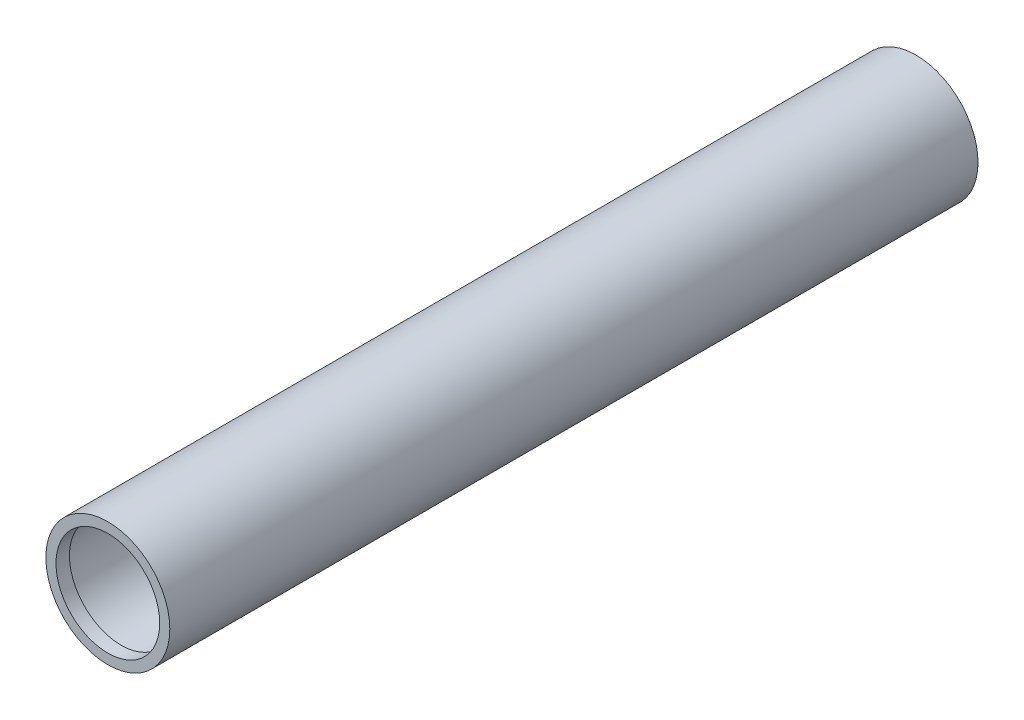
SolidWorks part; units mm, degrees
ref_plane "Front Plane" through (0, 0, 0) normal (0, 0, 1) x (1, 0, 0)
ref_plane "Top Plane" through (0, 0, 0) normal (0, 1, 0) x (1, 0, 0)
ref_plane "Right Plane" through (0, 0, 0) normal (1, 0, 0) x (0, 0, -1)
sketch "Sketch2" plane through (0, 0, 0) normal (0, 0, 1) x (1, 0, 0)
  circle A0 centre (0, 0) radius 23
  dimension "D1" = 46
extrude "Boss-Extrude1" add sketch "Sketch2" along normal blind 300
sketch "Sketch3" plane through (0, 0, 0) normal (0, 0, -1) x (-1, 0, 0)
  circle A0 centre (0, 0) radius 20.75
  dimension "D1" = 41.5
extrude "Cut-Extrude1" cut sketch "Sketch3" against normal blind 295
sketch "Sketch4" plane through (0, 0, 300) normal (0, 0, 1) x (1, 0, 0)
  circle A0 centre (0, 0) radius 19.25
  dimension "D1" = 38.5
extrude "Cut-Extrude2" cut sketch "Sketch4" against normal blind 295
